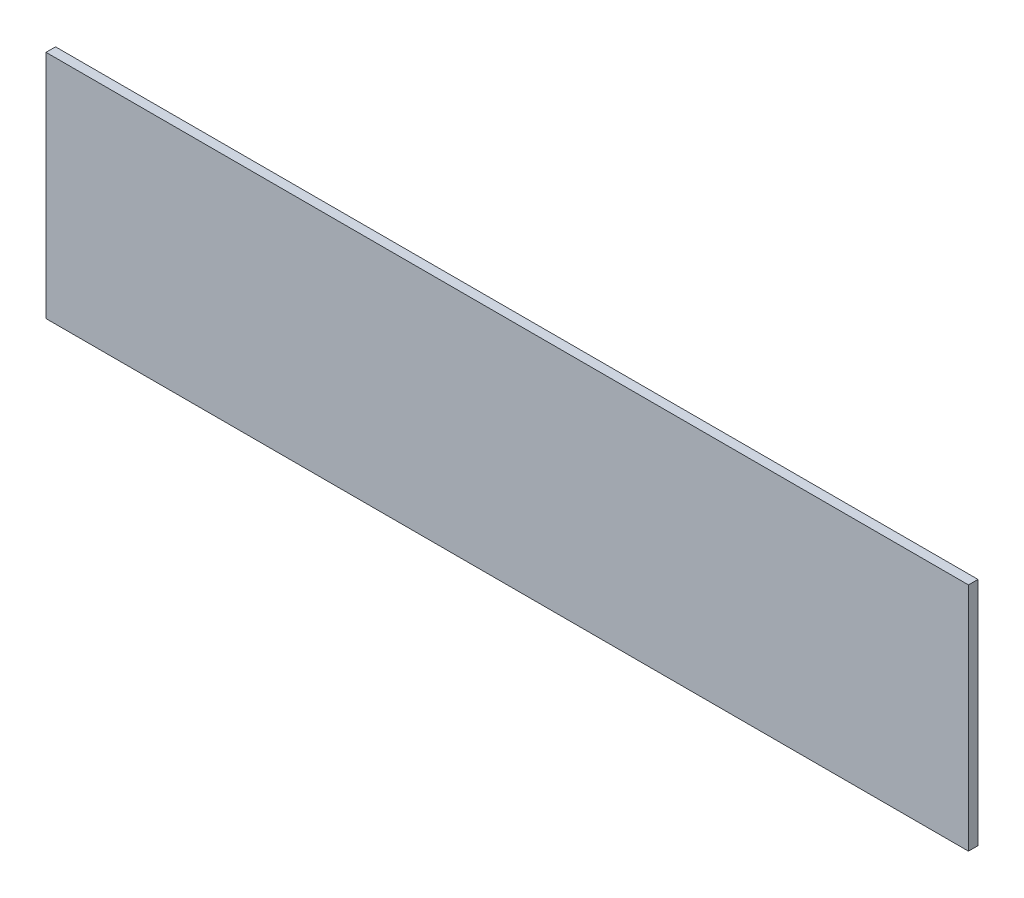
SolidWorks part; units mm, degrees
ref_plane "Front" through (0, 0, 0) normal (0, 0, 1) x (1, 0, 0)
ref_plane "Top" through (0, 0, 0) normal (0, 1, 0) x (1, 0, 0)
ref_plane "Right" through (0, 0, 0) normal (1, 0, 0) x (0, 0, -1)
sketch "Sketch1" plane through (0, 0, 0) normal (0, 0, 1) x (1, 0, 0)
  line L1 (0, 0) -> (968, 0)
  line L2 (0, 0) -> (0, 242)
  line L3 (0, 242) -> (968, 242)
  line L4 (968, 0) -> (968, 242)
  dimension "D1" = 242
  dimension "D2" = 968
extrude "Boss-Extrude1" add sketch "Sketch1" along normal blind 10
